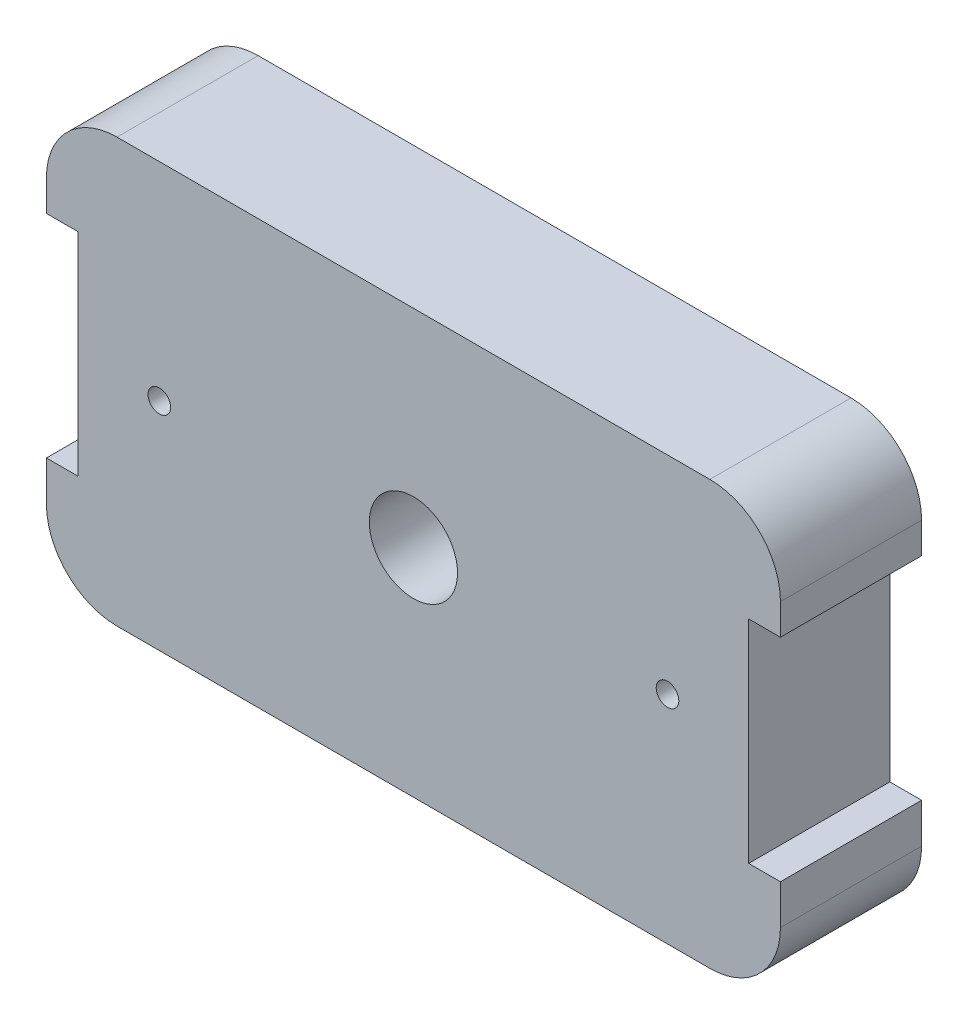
SolidWorks part; units mm, degrees
ref_plane "Piano frontale" through (0, 0, 0) normal (0, 0, 1) x (1, 0, 0)
ref_plane "Piano superiore" through (0, 0, 0) normal (0, 1, 0) x (1, 0, 0)
ref_plane "Piano destro" through (0, 0, 0) normal (1, 0, 0) x (0, 0, -1)
sketch "Sketch1" plane through (0, 0, 0) normal (0, 0, 1) x (1, 0, 0)
  line L1 (-47.5, 15) -> (-52, 15)
  line L2 (47.5, 15) -> (52, 15)
  line L3 (-47.5, 15) -> (-47.5, -15)
  line L4 (-47.5, -15) -> (-52, -15)
  line L5 (-52, -15) -> (-52, -30.6326)
  line L6 (-52, -30.6326) -> (52, -30.6326)
  line L7 (52, -30.6326) -> (52, -15)
  line L8 (52, -15) -> (47.5, -15)
  line L9 (47.5, -15) -> (47.5, 15)
  line L10 (-52, 15) -> (-52, 29.3674)
  line L18 (-52, 29.3674) -> (52, 29.3674)
  line L19 (52, 29.3674) -> (52, 15)
  line L20 (52, 15) -> (51.9762, 14.6795)
  circle A0 centre (36, 0) radius 1.6
  circle A1 centre (-36, 0) radius 1.6
  circle A2 centre (0, 0) radius 6.25
  dimension "D1" = 47.5
  dimension "D2" = 47.5
sketch "Sketch2" plane through (0, 0, 0) normal (0, 0, 1) x (1, 0, 0)
  line L0 (28, -28) -> (-28, -28)
  line L1 (28, -28) -> (28, 28)
  line L2 (28, 28) -> (-28, 28)
  line L3 (-28, -28) -> (-28, 28)
  line L4 (28, -28) -> (-28, 28) construction
  line L5 (28, 28) -> (-28, -28) construction
  dimension "D1" = 28
  dimension "D2" = 28
  dimension "D3" = 28
  dimension "D4" = 28
extrude "Boss-Extrude1" add sketch "Sketch1" along normal blind 20
fillet "Fillet1" radius 10 4 edges at (-52, -30.6326, 10) (52, -30.6326, 10) (52, 29.3674, 10) (-52, 29.3674, 10)
